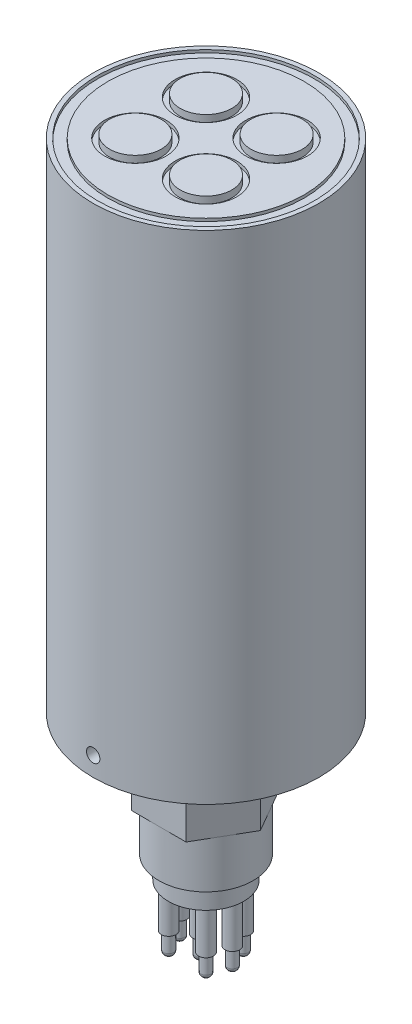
SolidWorks part; units mm, degrees
ref_plane "Front" through (0, 0, 0) normal (0, 0, 1) x (1, 0, 0)
ref_plane "Top" through (0, 0, 0) normal (0, 1, 0) x (1, 0, 0)
ref_plane "Right" through (0, 0, 0) normal (1, 0, 0) x (0, 0, -1)
sketch "Sketch1" plane through (0, 0, 0) normal (0, 1, 0) x (1, 0, 0)
  circle A0 centre (0, 0) radius 22.86
  dimension "D1" = 45.72
extrude "Boss-Extrude1" add sketch "Sketch1" along normal blind 100.584
sketch "Sketch2" plane through (0, 100.584, 0) normal (0, 1, 0) x (1, 0, 0)
  circle A0 centre (0, 0) radius 21.9456
  circle A2 centre (0, 0) radius 19.8628
extrude "Cut-Extrude1" cut sketch "Sketch2" against normal blind 0.5842
sketch "Sketch4" plane through (0, 100.584, 0) normal (0, 1, 0) x (1, 0, 0)
  line L0 (0, 0) -> (-16.4361, 0) construction
  line L1 (0, 0) -> (0, 17.578) construction
  circle A0 centre (-7.1437, 7.1437) radius 6.2547
  circle A1 centre (7.1437, 7.1437) radius 6.2547
  circle A2 centre (7.1437, -7.1437) radius 6.2547
  circle A3 centre (-7.1437, -7.1437) radius 6.2547
  dimension "D1" = 12.5095
  dimension "D3" = 13.3985
  dimension "D2" = 13.3985
extrude "Cut-Extrude4" cut sketch "Sketch4" against normal blind 0.7112
sketch "Sketch5" plane through (0, 99.8728, 0) normal (0, 1, 0) x (1, 0, 0)
  line L0 (0, 0) -> (0, 14.0298) construction
  line L1 (0, 0) -> (-15.5796, 0) construction
  circle A0 centre (-7.1437, 7.1437) radius 5.2324
  circle A1 centre (7.1437, 7.1437) radius 5.2324
  circle A2 centre (7.1437, -7.1437) radius 5.2324
  circle A3 centre (-7.1437, -7.1437) radius 5.2324
  dimension "D1" = 10.4648
extrude "Boss-Extrude2" add sketch "Sketch5" along normal blind 1.397
sketch "Sketch7" plane through (0, 0, 0) normal (0, -1, 0) x (1, 0, 0)
  line L1 (5.4993, 9.525) -> (-5.4993, 9.525)
  line L2 (-5.4993, 9.525) -> (-10.9985, 0)
  line L3 (-10.9985, 0) -> (-5.4993, -9.525)
  line L4 (-5.4993, -9.525) -> (5.4993, -9.525)
  line L5 (5.4993, -9.525) -> (10.9985, 0)
  line L6 (10.9985, 0) -> (5.4993, 9.525)
  circle A0 centre (0, 0) radius 9.525 construction
  dimension "D1" = 19.05
extrude "Boss-Extrude3" add sketch "Sketch7" along normal blind 15.24
sketch "Sketch8" plane through (0, -15.24, 0) normal (0, -1, 0) x (1, 0, 0)
  circle A0 centre (0, 0) radius 9.525
  dimension "D1" = 19.05
extrude "Boss-Extrude4" add sketch "Sketch8" along normal blind 9.525
sketch "Sketch9" plane through (0, -24.765, 0) normal (0, -1, 0) x (1, 0, 0)
  circle A0 centre (0, 0) radius 7.62
  dimension "D1" = 15.24
extrude "Boss-Extrude5" add sketch "Sketch9" along normal blind 4.572
sketch "Sketch10" plane through (0, -29.337, 0) normal (0, -1, 0) x (1, 0, 0)
  line L0 (0, 0) -> (3.7717, 3.7717) construction
  line L1 (0, 0) -> (0, 14.9678) construction
  circle A0 centre (3.7717, 3.7717) radius 1.4859
  dimension "D1" = 2.9718
  dimension "D2" = 5.334
  dimension "D3" = 45
extrude "Boss-Extrude6" add sketch "Sketch10" along normal blind 8.89
sketch "Sketch12" plane through (0, -38.227, 0) normal (0, -1, 0) x (1, 0, 0)
  circle A0 centre (3.7717, 3.7717) radius 1.016
  dimension "D1" = 2.032
extrude "Boss-Extrude7" add sketch "Sketch12" along normal blind 4.318
fillet "Fillet4" radius 0.9525 1 edges at (3.7717, -42.545, 2.7557)
pattern_circular "CirPattern1" count 7 every 45 about axis through (0, 0, 0) along (0, 1, 0) of "Boss-Extrude6", "Boss-Extrude7", "Fillet4"
pattern_linear "LPattern2" count 2 spacing 3.7719 along (-1, 0, 0) count 2 spacing 2.54 along (0, 0, -1) of "Boss-Extrude7", "Fillet4", "Boss-Extrude6"
ref_plane "Plane1" through (-22.86, 0, 0) normal (-1, 0, 0) x (0, 0, 1)
hole_wizard "#6-32 Tapped Hole1" positions "Sketch13" profile "Sketch14" tap size "#6-32" standard "ANSI Inch"
sketch "Sketch13" plane through (-22.86, 0, 0) normal (-1, 0, 0) x (0, 0, 1)
  line L0 (0, 100.584) -> (0, 0) construction
  line L2 (-22.86, 0) -> (22.86, 0) construction
  point P0 (0, 67.818)
  dimension "D1" = 67.818
sketch "Sketch14" plane through (-22.86, 67.818, 0) normal (0, 1, 0) x (0, 0, 1)
  line L0 (0, 0) -> (0, 10.2107)
  line L1 (0, 10.2107) -> (1.3525, 9.398)
  line L2 (1.3525, 9.398) -> (1.3525, 0)
  line L5 (1.3525, 0) -> (0, 0)
  line L10 (0, 10.2107) -> (-1.3526, 9.398) construction
  line L11 (0, -6.35) -> (0, 107.95) construction
  dimension "Tap Drill Dia." = 2.7051
  dimension "Tap Drill Depth" = 9.398
  dimension "Drill Angle" = 118
ref_plane "Plane2" through (0, 0, 22.86) normal (0, 0, 1) x (1, 0, 0)
hole_wizard "#6-32 Tapped Hole2" positions "Sketch15" profile "Sketch16" tap size "#6-32" standard "ANSI Inch"
sketch "Sketch15" plane through (0, 0, 22.86) normal (0, 0, 1) x (1, 0, 0)
  line L0 (0, 100.584) -> (0, 0) construction
  line L1 (-22.86, 0) -> (22.86, 0) construction
  point P0 (0, 3.9)
  dimension "D1" = 3.9
sketch "Sketch16" plane through (0, 3.9, 22.86) normal (1, 0, 0) x (0, -1, 0)
  line L0 (0, 0) -> (0, 10.2107)
  line L1 (0, 10.2107) -> (1.3525, 9.398)
  line L2 (1.3525, 9.398) -> (1.3525, 0)
  line L5 (1.3525, 0) -> (0, 0)
  line L10 (0, 10.2107) -> (-1.3525, 9.398) construction
  line L11 (0, -6.35) -> (0, 107.95) construction
  dimension "Tap Drill Dia." = 2.7051
  dimension "Tap Drill Depth" = 9.398
  dimension "Drill Angle" = 118
